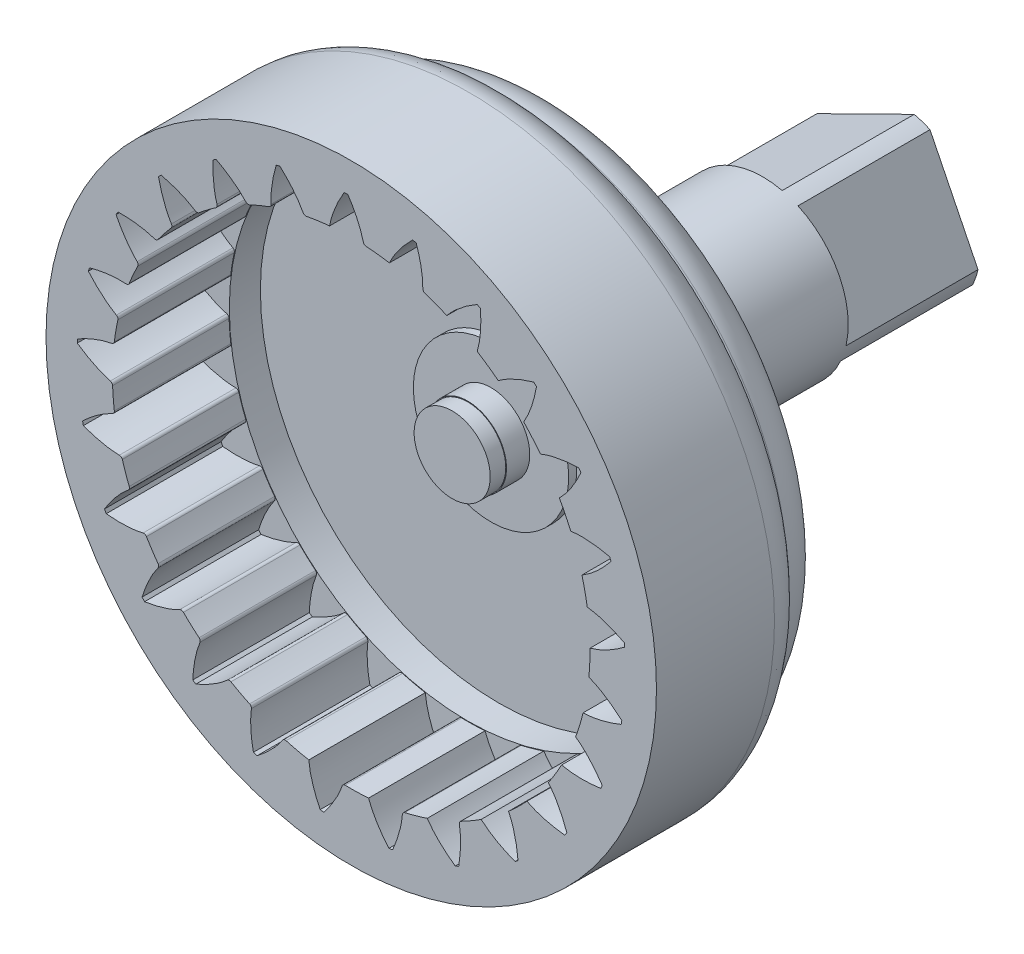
SolidWorks part; units mm, degrees
ref_plane "Plan de face" through (0, 0, 0) normal (0, 0, 1) x (1, 0, 0)
ref_plane "Plan de dessus" through (0, 0, 0) normal (0, 1, 0) x (1, 0, 0)
ref_plane "Plan de droite" through (0, 0, 0) normal (1, 0, 0) x (0, 0, -1)
ref_plane "Plan4" through (0, 0, 0) normal (0, -1, 0) x (1, 0, 0)
sketch "Esquisse1" plane through (0, 0, 0) normal (0, -1, 0) x (1, 0, 0)
  line L0 (3.9307, 4.1) -> (0, 4.1)
  line L1 (0, 4.1) -> (0, 1.5)
  line L2 (0, 1.5) -> (3.5707, 1.5)
  line L3 (3.5707, 1.5) -> (3.5707, 2.1)
  line L4 (3.9307, 2.58) -> (3.9307, 4.1)
  line L5 (0, 4.1) -> (0, 1.5) construction
  spline S0 degree 3 poles (3.5707, 2.1) (3.7627, 2.156) (3.9307, 2.38) (3.9307, 2.58) knots 0 0 0 0 1 1 1 1
revolve "Révolution1" add sketch "Esquisse1" angle 360 about L5
sketch "Esquisse2" plane through (0, 0, 1.5) normal (0, 0, -1) x (-1, 0, 0)
  circle A0 centre (0, 0) radius 1.1
extrude "Boss.-Extru.1" add sketch "Esquisse2" along normal blind 4.4
sketch "Esquisse3" plane through (0, 0, -2.9) normal (0, 0, -1) x (-1, 0, 0)
  line L0 (1.0713, 0.2496) -> (0.4529, -1.0024)
  arc A0 (0.4529, -1.0024) -> (1.0713, 0.2496) centre (0, 0) ccw
extrude "Enlèv. mat.-Extru.1" cut sketch "Esquisse3" against normal blind 1.7
sketch "Esquisse4" plane through (0, 0, -2.9) normal (0, 0, -1) x (-1, 0, 0)
  line L0 (-0.2496, 1.0713) -> (1.0024, 0.4529)
  arc A0 (1.0024, 0.4529) -> (-0.2496, 1.0713) centre (0, 0) ccw
extrude "Enlèv. mat.-Extru.2" cut sketch "Esquisse4" against normal blind 1.7
sketch "Esquisse5" plane through (0, 0, -2.9) normal (0, 0, -1) x (-1, 0, 0)
  line L0 (0.2496, -1.0713) -> (-1.0024, -0.4529)
  arc A0 (-1.0024, -0.4529) -> (0.2496, -1.0713) centre (0, 0) ccw
extrude "Enlèv. mat.-Extru.3" cut sketch "Esquisse5" against normal blind 1.7
sketch "Esquisse6" plane through (0, 0, -2.9) normal (0, 0, -1) x (-1, 0, 0)
  line L0 (-1.0713, -0.2496) -> (-0.4529, 1.0024)
  arc A0 (-0.4529, 1.0024) -> (-1.0713, -0.2496) centre (0, 0) ccw
extrude "Enlèv. mat.-Extru.4" cut sketch "Esquisse6" against normal blind 1.7
sketch "Esquisse7" plane through (0, 0, 4.1) normal (0, 0, 1) x (1, 0, 0)
  arc A0 (1.231, 2.818) -> (0.9214, 2.9339) centre (0, 0) ccw
  arc A1 (0.8366, 3.4302) -> (0.7899, 3.4413) centre (0, 0) ccw
  arc A2 (0.4915, 3.0356) -> (0.1629, 3.0708) centre (0, 0) ccw
  arc A3 (-0.0428, 3.5305) -> (-0.0907, 3.5296) centre (0, 0) ccw
  arc A4 (-0.2788, 3.0625) -> (-0.6059, 3.0149) centre (0, 0) ccw
  arc A5 (-0.9194, 3.4089) -> (-0.9656, 3.3961) centre (0, 0) ccw
  arc A6 (-1.0317, 2.8969) -> (-1.3367, 2.7695) centre (0, 0) ccw
  arc A7 (-1.7383, 3.0732) -> (-1.7799, 3.0493) centre (0, 0) ccw
  arc A8 (-1.7197, 2.5493) -> (-1.9834, 2.35) centre (0, 0) ccw
  arc A9 (-2.448, 2.5443) -> (-2.4823, 2.5108) centre (0, 0) ccw
  arc A10 (-2.2997, 2.0416) -> (-2.5055, 1.783) centre (0, 0) ccw
  arc A11 (-3.0038, 1.8556) -> (-3.0287, 1.8146) centre (0, 0) ccw
  arc A12 (-2.7352, 1.4055) -> (-2.8702, 1.1039) centre (0, 0) ccw
  arc A13 (-3.3709, 1.0503) -> (-3.3849, 1.0044) centre (0, 0) ccw
  arc A14 (-2.9988, 0.6812) -> (-3.0546, 0.3554) centre (0, 0) ccw
  arc A15 (-3.5262, 0.179) -> (-3.5283, 0.1311) centre (0, 0) ccw
  arc A16 (-3.074, -0.086) -> (-3.047, -0.4154) centre (0, 0) ccw
  arc A17 (-3.4599, -0.7036) -> (-3.4501, -0.7505) centre (0, 0) ccw
  arc A18 (-2.956, -0.8478) -> (-2.8479, -1.1601) centre (0, 0) ccw
  arc A19 (-3.1763, -1.5419) -> (-3.155, -1.5849) centre (0, 0) ccw
  arc A20 (-2.6523, -1.5563) -> (-2.47, -1.8319) centre (0, 0) ccw
  arc A21 (-2.693, -2.2834) -> (-2.6618, -2.3197) centre (0, 0) ccw
  arc A22 (-2.1819, -2.167) -> (-1.9368, -2.3886) centre (0, 0) ccw
  arc A23 (-2.0406, -2.8814) -> (-2.0012, -2.9088) centre (0, 0) ccw
  arc A24 (-1.5745, -2.6415) -> (-1.2819, -2.7952) centre (0, 0) ccw
  arc A25 (-1.2599, -3.2983) -> (-1.215, -3.3151) centre (0, 0) ccw
  arc A26 (-0.8681, -2.9501) -> (-0.5465, -3.0262) centre (0, 0) ccw
  arc A27 (-0.4001, -3.508) -> (-0.3524, -3.5131) centre (0, 0) ccw
  arc A28 (-0.1072, -3.0733) -> (0.2233, -3.067) centre (0, 0) ccw
  arc A29 (0.4849, -3.4973) -> (0.5324, -3.4904) centre (0, 0) ccw
  arc A30 (0.6605, -3.0034) -> (0.979, -2.9152) centre (0, 0) ccw
  arc A31 (1.3394, -3.2668) -> (1.3837, -3.2483) centre (0, 0) ccw
  arc A32 (1.3866, -2.7448) -> (1.6732, -2.5801) centre (0, 0) ccw
  arc A33 (2.1098, -2.8311) -> (2.148, -2.8022) centre (0, 0) ccw
  arc A34 (2.0257, -2.3137) -> (2.2623, -2.0829) centre (0, 0) ccw
  arc A35 (2.7475, -2.2175) -> (2.7774, -2.1799) centre (0, 0) ccw
  arc A36 (2.5374, -1.7373) -> (2.7092, -1.4549) centre (0, 0) ccw
  arc A37 (3.2127, -1.4645) -> (3.2323, -1.4207) centre (0, 0) ccw
  arc A38 (2.8898, -1.0516) -> (2.9859, -0.7354) centre (0, 0) ccw
  arc A39 (3.476, -0.6195) -> (3.4841, -0.5723) centre (0, 0) ccw
  arc A40 (3.0605, -0.2999) -> (3.075, 0.0303) centre (0, 0) ccw
  arc A41 (3.5208, 0.2644) -> (3.5169, 0.3122) centre (0, 0) ccw
  arc A42 (3.0389, 0.4706) -> (2.9709, 0.794) centre (0, 0) ccw
  arc A43 (3.3445, 1.1317) -> (3.3288, 1.177) centre (0, 0) ccw
  arc A44 (2.8264, 1.2116) -> (2.6799, 1.5082) centre (0, 0) ccw
  arc A45 (2.958, 1.9278) -> (2.9315, 1.9678) centre (0, 0) ccw
  arc A46 (2.4366, 1.8761) -> (2.2209, 2.1271) centre (0, 0) ccw
  arc A47 (2.3856, 2.6029) -> (2.35, 2.6351) centre (0, 0) ccw
  arc A48 (1.8932, 2.4233) -> (1.6221, 2.6125) centre (0, 0) ccw
  arc A49 (1.6633, 3.1144) -> (1.6209, 3.1367) centre (0, 0) ccw
  spline S0 degree 3 poles (0.8366, 3.4302) (0.8499, 3.3911) (0.8621, 3.3516) (0.8728, 3.3116) (0.8835, 3.2717) (0.8928, 3.2314) (0.9004, 3.1908) (0.9143, 3.1159) (0.9228, 3.0395) (0.9219, 2.9634) (0.9218, 2.9536) (0.9216, 2.9437) (0.9214, 2.9339) knots 0 0 0 0 0.000124 0.000124 0.000124 0.000248 0.000248 0.000248 0.000477 0.000477 0.000477 0.000507 0.000507 0.000507 0.000507
  spline S1 degree 3 poles (0.4915, 3.0356) (0.4958, 3.0445) (0.5, 3.0534) (0.5043, 3.0622) (0.5225, 3.0994) (0.5431, 3.1355) (0.5655, 3.1703) (0.5879, 3.2051) (0.612, 3.2387) (0.6375, 3.2713) (0.6843, 3.3313) (0.7356, 3.3879) (0.7899, 3.4413) knots -0.000029 -0.000029 -0.000029 -0.000029 0 0 0 0.000124 0.000124 0.000124 0.000248 0.000248 0.000248 0.000477 0.000477 0.000477 0.000477
  spline S2 degree 3 poles (-0.0428, 3.5305) (-0.0201, 3.4959) (0.0015, 3.4606) (0.0218, 3.4247) (0.0421, 3.3886) (0.0611, 3.3519) (0.0786, 3.3144) (0.1107, 3.2454) (0.1379, 3.1735) (0.156, 3.0996) (0.1583, 3.09) (0.1606, 3.0804) (0.1629, 3.0708) knots 0 0 0 0 0.000124 0.000124 0.000124 0.000248 0.000248 0.000248 0.000477 0.000477 0.000477 0.000507 0.000507 0.000507 0.000507
  spline S3 degree 3 poles (-0.2788, 3.0625) (-0.2769, 3.0722) (-0.275, 3.0818) (-0.2731, 3.0915) (-0.2648, 3.132) (-0.2538, 3.1721) (-0.2407, 3.2113) (-0.2277, 3.2506) (-0.2126, 3.2892) (-0.1961, 3.3271) (-0.1657, 3.3968) (-0.13, 3.4644) (-0.0907, 3.5296) knots -0.000029 -0.000029 -0.000029 -0.000029 0 0 0 0.000124 0.000124 0.000124 0.000248 0.000248 0.000248 0.000477 0.000477 0.000477 0.000477
  spline S4 degree 3 poles (-0.9194, 3.4089) (-0.8889, 3.3811) (-0.8592, 3.3523) (-0.8306, 3.3225) (-0.802, 3.2927) (-0.7744, 3.2618) (-0.7482, 3.2298) (-0.6999, 3.171) (-0.6556, 3.1081) (-0.6197, 3.041) (-0.6151, 3.0323) (-0.6105, 3.0236) (-0.6059, 3.0149) knots 0 0 0 0 0.000124 0.000124 0.000124 0.000248 0.000248 0.000248 0.000477 0.000477 0.000477 0.000507 0.000507 0.000507 0.000507
  spline S5 degree 3 poles (-1.0317, 2.8969) (-1.0322, 2.9068) (-1.0328, 2.9166) (-1.0333, 2.9264) (-1.0353, 2.9678) (-1.0347, 3.0093) (-1.0318, 3.0506) (-1.0289, 3.0918) (-1.0239, 3.133) (-1.0174, 3.1738) (-1.0052, 3.2489) (-0.9875, 3.3232) (-0.9656, 3.3961) knots -0.000029 -0.000029 -0.000029 -0.000029 0 0 0 0.000124 0.000124 0.000124 0.000248 0.000248 0.000248 0.000477 0.000477 0.000477 0.000477
  spline S6 degree 3 poles (-1.7383, 3.0732) (-1.7018, 3.0538) (-1.6659, 3.0333) (-1.6307, 3.0115) (-1.5956, 2.9898) (-1.5612, 2.9667) (-1.5279, 2.9423) (-1.4665, 2.8973) (-1.408, 2.8474) (-1.3565, 2.7913) (-1.3499, 2.7841) (-1.3433, 2.7768) (-1.3367, 2.7695) knots 0 0 0 0 0.000124 0.000124 0.000124 0.000248 0.000248 0.000248 0.000477 0.000477 0.000477 0.000507 0.000507 0.000507 0.000507
  spline S7 degree 3 poles (-1.7197, 2.5493) (-1.7227, 2.5587) (-1.7257, 2.5681) (-1.7286, 2.5775) (-1.7409, 2.617) (-1.7505, 2.6574) (-1.758, 2.6981) (-1.7655, 2.7388) (-1.7709, 2.7799) (-1.7747, 2.8211) (-1.7816, 2.8968) (-1.783, 2.9733) (-1.7799, 3.0493) knots -0.000029 -0.000029 -0.000029 -0.000029 0 0 0 0.000124 0.000124 0.000124 0.000248 0.000248 0.000248 0.000477 0.000477 0.000477 0.000477
  spline S8 degree 3 poles (-2.448, 2.5443) (-2.4078, 2.5347) (-2.3679, 2.5237) (-2.3284, 2.5114) (-2.289, 2.499) (-2.25, 2.4853) (-2.2116, 2.4699) (-2.1409, 2.4416) (-2.0719, 2.4078) (-2.0081, 2.3663) (-1.9998, 2.3609) (-1.9916, 2.3555) (-1.9834, 2.35) knots 0 0 0 0 0.000124 0.000124 0.000124 0.000248 0.000248 0.000248 0.000477 0.000477 0.000477 0.000507 0.000507 0.000507 0.000507
  spline S9 degree 3 poles (-2.2997, 2.0416) (-2.3049, 2.0499) (-2.3101, 2.0583) (-2.3153, 2.0667) (-2.337, 2.1019) (-2.3564, 2.1386) (-2.3738, 2.1762) (-2.3911, 2.2137) (-2.4066, 2.2521) (-2.4205, 2.2911) (-2.4461, 2.3628) (-2.4664, 2.4364) (-2.4823, 2.5108) knots -0.000029 -0.000029 -0.000029 -0.000029 0 0 0 0.000124 0.000124 0.000124 0.000248 0.000248 0.000248 0.000477 0.000477 0.000477 0.000477
  spline S10 degree 3 poles (-3.0038, 1.8556) (-2.9625, 1.8563) (-2.9211, 1.8556) (-2.8799, 1.8534) (-2.8386, 1.8513) (-2.7973, 1.8476) (-2.7564, 1.8423) (-2.6809, 1.8325) (-2.6056, 1.8169) (-2.5335, 1.7925) (-2.5241, 1.7894) (-2.5148, 1.7862) (-2.5055, 1.783) knots 0 0 0 0 0.000124 0.000124 0.000124 0.000248 0.000248 0.000248 0.000477 0.000477 0.000477 0.000507 0.000507 0.000507 0.000507
  spline S11 degree 3 poles (-2.7352, 1.4055) (-2.7423, 1.4123) (-2.7494, 1.4191) (-2.7565, 1.4259) (-2.7863, 1.4547) (-2.8142, 1.4854) (-2.8404, 1.5175) (-2.8665, 1.5495) (-2.8911, 1.5829) (-2.9142, 1.6172) (-2.9568, 1.6802) (-2.9948, 1.7465) (-3.0287, 1.8146) knots -0.000029 -0.000029 -0.000029 -0.000029 0 0 0 0.000124 0.000124 0.000124 0.000248 0.000248 0.000248 0.000477 0.000477 0.000477 0.000477
  spline S12 degree 3 poles (-3.3709, 1.0503) (-3.331, 1.0612) (-3.2908, 1.0708) (-3.2503, 1.079) (-3.2098, 1.0872) (-3.1689, 1.0939) (-3.1279, 1.0989) (-3.0524, 1.1082) (-2.9756, 1.1118) (-2.8997, 1.1062) (-2.8898, 1.1054) (-2.88, 1.1046) (-2.8702, 1.1039) knots 0 0 0 0 0.000124 0.000124 0.000124 0.000248 0.000248 0.000248 0.000477 0.000477 0.000477 0.000507 0.000507 0.000507 0.000507
  spline S13 degree 3 poles (-2.9988, 0.6812) (-3.0074, 0.686) (-3.016, 0.6908) (-3.0245, 0.6956) (-3.0605, 0.716) (-3.0952, 0.7389) (-3.1285, 0.7634) (-3.1618, 0.7879) (-3.1939, 0.8142) (-3.2248, 0.8416) (-3.2818, 0.8921) (-3.3351, 0.9469) (-3.3849, 1.0044) knots -0.000029 -0.000029 -0.000029 -0.000029 0 0 0 0.000124 0.000124 0.000124 0.000248 0.000248 0.000248 0.000477 0.000477 0.000477 0.000477
  spline S14 degree 3 poles (-3.5262, 0.179) (-3.4903, 0.1995) (-3.4537, 0.2188) (-3.4165, 0.2368) (-3.3793, 0.2548) (-3.3414, 0.2715) (-3.3029, 0.2865) (-3.2321, 0.3143) (-3.1586, 0.3369) (-3.0837, 0.3503) (-3.074, 0.352) (-3.0643, 0.3537) (-3.0546, 0.3554) knots 0 0 0 0 0.000124 0.000124 0.000124 0.000248 0.000248 0.000248 0.000477 0.000477 0.000477 0.000507 0.000507 0.000507 0.000507
  spline S15 degree 3 poles (-3.074, -0.086) (-3.0835, -0.0835) (-3.093, -0.081) (-3.1025, -0.0784) (-3.1424, -0.0676) (-3.1817, -0.0541) (-3.2201, -0.0386) (-3.2584, -0.0231) (-3.296, -0.0057) (-3.3328, 0.0132) (-3.4005, 0.0479) (-3.4658, 0.0877) (-3.5283, 0.1311) knots -0.000029 -0.000029 -0.000029 -0.000029 0 0 0 0.000124 0.000124 0.000124 0.000248 0.000248 0.000248 0.000477 0.000477 0.000477 0.000477
  spline S16 degree 3 poles (-3.4599, -0.7036) (-3.4303, -0.6748) (-3.3996, -0.647) (-3.3681, -0.6203) (-3.3365, -0.5936) (-3.304, -0.568) (-3.2704, -0.5439) (-3.2087, -0.4994) (-3.1432, -0.4592) (-3.0739, -0.4276) (-3.0649, -0.4235) (-3.056, -0.4195) (-3.047, -0.4154) knots 0 0 0 0 0.000124 0.000124 0.000124 0.000248 0.000248 0.000248 0.000477 0.000477 0.000477 0.000507 0.000507 0.000507 0.000507
  spline S17 degree 3 poles (-2.956, -0.8478) (-2.9658, -0.8477) (-2.9757, -0.8476) (-2.9855, -0.8475) (-3.0269, -0.847) (-3.0683, -0.8437) (-3.1093, -0.8382) (-3.1503, -0.8327) (-3.1911, -0.8252) (-3.2314, -0.8161) (-3.3056, -0.7993) (-3.3787, -0.7769) (-3.4501, -0.7505) knots -0.000029 -0.000029 -0.000029 -0.000029 0 0 0 0.000124 0.000124 0.000124 0.000248 0.000248 0.000248 0.000477 0.000477 0.000477 0.000477
  spline S18 degree 3 poles (-3.1763, -1.5419) (-3.1547, -1.5067) (-3.1319, -1.4721) (-3.108, -1.4384) (-3.0841, -1.4047) (-3.0589, -1.3719) (-3.0324, -1.3401) (-2.9837, -1.2816) (-2.9302, -1.2264) (-2.871, -1.1786) (-2.8633, -1.1724) (-2.8556, -1.1663) (-2.8479, -1.1601) knots 0 0 0 0 0.000124 0.000124 0.000124 0.000248 0.000248 0.000248 0.000477 0.000477 0.000477 0.000507 0.000507 0.000507 0.000507
  spline S19 degree 3 poles (-2.6523, -1.5563) (-2.6619, -1.5586) (-2.6714, -1.561) (-2.681, -1.5634) (-2.7212, -1.5731) (-2.7621, -1.5802) (-2.8032, -1.5851) (-2.8443, -1.59) (-2.8856, -1.5929) (-2.9269, -1.594) (-3.003, -1.5962) (-3.0793, -1.5928) (-3.155, -1.5849) knots -0.000029 -0.000029 -0.000029 -0.000029 0 0 0 0.000124 0.000124 0.000124 0.000248 0.000248 0.000248 0.000477 0.000477 0.000477 0.000477
  spline S20 degree 3 poles (-2.693, -2.2834) (-2.6809, -2.2439) (-2.6674, -2.2047) (-2.6526, -2.1662) (-2.6378, -2.1276) (-2.6216, -2.0895) (-2.6039, -2.0522) (-2.5712, -1.9834) (-2.5332, -1.9166) (-2.4877, -1.8555) (-2.4818, -1.8476) (-2.4759, -1.8398) (-2.47, -1.8319) knots 0 0 0 0 0.000124 0.000124 0.000124 0.000248 0.000248 0.000248 0.000477 0.000477 0.000477 0.000507 0.000507 0.000507 0.000507
  spline S21 degree 3 poles (-2.1819, -2.167) (-2.1906, -2.1716) (-2.1993, -2.1763) (-2.208, -2.181) (-2.2445, -2.2004) (-2.2823, -2.2175) (-2.3209, -2.2325) (-2.3595, -2.2474) (-2.3988, -2.2604) (-2.4386, -2.2719) (-2.5117, -2.2929) (-2.5865, -2.3085) (-2.6618, -2.3197) knots -0.000029 -0.000029 -0.000029 -0.000029 0 0 0 0.000124 0.000124 0.000124 0.000248 0.000248 0.000248 0.000477 0.000477 0.000477 0.000477
  spline S22 degree 3 poles (-2.0406, -2.8814) (-2.0386, -2.8401) (-2.0353, -2.7988) (-2.0306, -2.7578) (-2.0258, -2.7167) (-2.0196, -2.6758) (-2.0117, -2.6352) (-1.9972, -2.5605) (-1.9769, -2.4864) (-1.9481, -2.4159) (-1.9444, -2.4068) (-1.9405, -2.3977) (-1.9368, -2.3886) knots 0 0 0 0 0.000124 0.000124 0.000124 0.000248 0.000248 0.000248 0.000477 0.000477 0.000477 0.000507 0.000507 0.000507 0.000507
  spline S23 degree 3 poles (-1.5745, -2.6415) (-1.5817, -2.6482) (-1.5889, -2.6549) (-1.5962, -2.6615) (-1.6267, -2.6895) (-1.6592, -2.7154) (-1.6928, -2.7395) (-1.7264, -2.7636) (-1.7613, -2.786) (-1.797, -2.8069) (-1.8626, -2.8455) (-1.9311, -2.8792) (-2.0012, -2.9088) knots -0.000029 -0.000029 -0.000029 -0.000029 0 0 0 0.000124 0.000124 0.000124 0.000248 0.000248 0.000248 0.000477 0.000477 0.000477 0.000477
  spline S24 degree 3 poles (-1.2599, -3.2983) (-1.2683, -3.2578) (-1.2753, -3.2171) (-1.281, -3.1761) (-1.2866, -3.1352) (-1.2907, -3.094) (-1.2932, -3.0527) (-1.2977, -2.9768) (-1.2965, -2.8999) (-1.2861, -2.8245) (-1.2847, -2.8147) (-1.2833, -2.805) (-1.2819, -2.7952) knots 0 0 0 0 0.000124 0.000124 0.000124 0.000248 0.000248 0.000248 0.000477 0.000477 0.000477 0.000507 0.000507 0.000507 0.000507
  spline S25 degree 3 poles (-0.8681, -2.9501) (-0.8735, -2.9584) (-0.8788, -2.9666) (-0.8842, -2.9749) (-0.9068, -3.0095) (-0.9318, -3.0427) (-0.9583, -3.0744) (-0.9849, -3.1061) (-1.0131, -3.1365) (-1.0424, -3.1656) (-1.0964, -3.2193) (-1.1544, -3.269) (-1.215, -3.3151) knots -0.000029 -0.000029 -0.000029 -0.000029 0 0 0 0.000124 0.000124 0.000124 0.000248 0.000248 0.000248 0.000477 0.000477 0.000477 0.000477
  spline S26 degree 3 poles (-0.4001, -3.508) (-0.4182, -3.4709) (-0.4352, -3.4332) (-0.4508, -3.3949) (-0.4665, -3.3567) (-0.4807, -3.3178) (-0.4934, -3.2784) (-0.5166, -3.206) (-0.5346, -3.1312) (-0.5432, -3.0556) (-0.5444, -3.0458) (-0.5454, -3.036) (-0.5465, -3.0262) knots 0 0 0 0 0.000124 0.000124 0.000124 0.000248 0.000248 0.000248 0.000477 0.000477 0.000477 0.000507 0.000507 0.000507 0.000507
  spline S27 degree 3 poles (-0.1072, -3.0733) (-0.1103, -3.0826) (-0.1134, -3.092) (-0.1166, -3.1013) (-0.1299, -3.1405) (-0.1458, -3.1788) (-0.1637, -3.2162) (-0.1815, -3.2535) (-0.2013, -3.2899) (-0.2224, -3.3254) (-0.2614, -3.3908) (-0.3052, -3.4534) (-0.3524, -3.5131) knots -0.000029 -0.000029 -0.000029 -0.000029 0 0 0 0.000124 0.000124 0.000124 0.000248 0.000248 0.000248 0.000477 0.000477 0.000477 0.000477
  spline S28 degree 3 poles (0.4849, -3.4973) (0.4581, -3.4659) (0.4322, -3.4335) (0.4076, -3.4004) (0.383, -3.3672) (0.3595, -3.3331) (0.3375, -3.2981) (0.2969, -3.2337) (0.2609, -3.1658) (0.2337, -3.0947) (0.2302, -3.0855) (0.2268, -3.0763) (0.2233, -3.067) knots 0 0 0 0 0.000124 0.000124 0.000124 0.000248 0.000248 0.000248 0.000477 0.000477 0.000477 0.000507 0.000507 0.000507 0.000507
  spline S29 degree 3 poles (0.6605, -3.0034) (0.6598, -3.0132) (0.6591, -3.023) (0.6584, -3.0329) (0.6552, -3.0741) (0.6493, -3.1152) (0.6413, -3.1558) (0.6333, -3.1964) (0.6232, -3.2366) (0.6116, -3.2763) (0.5901, -3.3493) (0.5632, -3.4208) (0.5324, -3.4904) knots -0.000029 -0.000029 -0.000029 -0.000029 0 0 0 0.000124 0.000124 0.000124 0.000248 0.000248 0.000248 0.000477 0.000477 0.000477 0.000477
  spline S30 degree 3 poles (1.3394, -3.2668) (1.3056, -3.243) (1.2726, -3.2182) (1.2404, -3.1922) (1.2083, -3.1662) (1.1771, -3.139) (1.1471, -3.1106) (1.0918, -3.0583) (1.04, -3.0014) (0.996, -2.9393) (0.9903, -2.9313) (0.9847, -2.9232) (0.979, -2.9152) knots 0 0 0 0 0.000124 0.000124 0.000124 0.000248 0.000248 0.000248 0.000477 0.000477 0.000477 0.000507 0.000507 0.000507 0.000507
  spline S31 degree 3 poles (1.3866, -2.7448) (1.3884, -2.7545) (1.3902, -2.7641) (1.3919, -2.7738) (1.3991, -2.8146) (1.4037, -2.8559) (1.406, -2.8972) (1.4083, -2.9385) (1.4085, -2.9799) (1.4071, -3.0212) (1.4045, -3.0973) (1.3963, -3.1733) (1.3837, -3.2483) knots -0.000029 -0.000029 -0.000029 -0.000029 0 0 0 0.000124 0.000124 0.000124 0.000248 0.000248 0.000248 0.000477 0.000477 0.000477 0.000477
  spline S32 degree 3 poles (2.1098, -2.8311) (2.0711, -2.8165) (2.0329, -2.8006) (1.9953, -2.7834) (1.9577, -2.7662) (1.9207, -2.7477) (1.8846, -2.7276) (1.818, -2.6907) (1.7538, -2.6485) (1.6957, -2.5993) (1.6882, -2.5929) (1.6807, -2.5865) (1.6732, -2.5801) knots 0 0 0 0 0.000124 0.000124 0.000124 0.000248 0.000248 0.000248 0.000477 0.000477 0.000477 0.000507 0.000507 0.000507 0.000507
  spline S33 degree 3 poles (2.0257, -2.3137) (2.0298, -2.3227) (2.034, -2.3316) (2.038, -2.3405) (2.0551, -2.3782) (2.0698, -2.4171) (2.0823, -2.4565) (2.0948, -2.4959) (2.1054, -2.536) (2.1143, -2.5764) (2.1306, -2.6507) (2.1416, -2.7263) (2.148, -2.8022) knots -0.000029 -0.000029 -0.000029 -0.000029 0 0 0 0.000124 0.000124 0.000124 0.000248 0.000248 0.000248 0.000477 0.000477 0.000477 0.000477
  spline S34 degree 3 poles (2.7475, -2.2175) (2.7065, -2.2129) (2.6655, -2.2071) (2.6248, -2.1997) (2.5842, -2.1924) (2.5437, -2.1837) (2.5037, -2.1732) (2.4301, -2.154) (2.3573, -2.1291) (2.2888, -2.0959) (2.28, -2.0916) (2.2711, -2.0873) (2.2623, -2.0829) knots 0 0 0 0 0.000124 0.000124 0.000124 0.000248 0.000248 0.000248 0.000477 0.000477 0.000477 0.000507 0.000507 0.000507 0.000507
  spline S35 degree 3 poles (2.5374, -1.7373) (2.5436, -1.7449) (2.5499, -1.7525) (2.5561, -1.7602) (2.582, -1.7924) (2.6059, -1.8264) (2.6278, -1.8615) (2.6497, -1.8966) (2.6699, -1.9328) (2.6886, -1.9697) (2.7229, -2.0376) (2.7523, -2.1081) (2.7774, -2.1799) knots -0.000029 -0.000029 -0.000029 -0.000029 0 0 0 0.000124 0.000124 0.000124 0.000248 0.000248 0.000248 0.000477 0.000477 0.000477 0.000477
  spline S36 degree 3 poles (3.2127, -1.4645) (3.1718, -1.4703) (3.1306, -1.4748) (3.0894, -1.4779) (3.0482, -1.4809) (3.0069, -1.4825) (2.9655, -1.4823) (2.8894, -1.482) (2.8128, -1.476) (2.7382, -1.4609) (2.7285, -1.4589) (2.7189, -1.4569) (2.7092, -1.4549) knots 0 0 0 0 0.000124 0.000124 0.000124 0.000248 0.000248 0.000248 0.000477 0.000477 0.000477 0.000507 0.000507 0.000507 0.000507
  spline S37 degree 3 poles (2.8898, -1.0516) (2.8977, -1.0575) (2.9056, -1.0633) (2.9135, -1.0692) (2.9466, -1.094) (2.9782, -1.121) (3.0082, -1.1495) (3.0381, -1.178) (3.0667, -1.2081) (3.0939, -1.2392) (3.1441, -1.2964) (3.1901, -1.3574) (3.2323, -1.4207) knots -0.000029 -0.000029 -0.000029 -0.000029 0 0 0 0.000124 0.000124 0.000124 0.000248 0.000248 0.000248 0.000477 0.000477 0.000477 0.000477
  spline S38 degree 3 poles (3.476, -0.6195) (3.4378, -0.6353) (3.3991, -0.6499) (3.3599, -0.6631) (3.3207, -0.6763) (3.2811, -0.6881) (3.241, -0.6982) (3.1672, -0.7169) (3.0915, -0.7301) (3.0154, -0.734) (3.0056, -0.7345) (2.9958, -0.735) (2.9859, -0.7354) knots 0 0 0 0 0.000124 0.000124 0.000124 0.000248 0.000248 0.000248 0.000477 0.000477 0.000477 0.000507 0.000507 0.000507 0.000507
  spline S39 degree 3 poles (3.0605, -0.2999) (3.0696, -0.3036) (3.0788, -0.3073) (3.0879, -0.3111) (3.1261, -0.3268) (3.1634, -0.3451) (3.1995, -0.3653) (3.2357, -0.3854) (3.2708, -0.4075) (3.3049, -0.4308) (3.3677, -0.4737) (3.4274, -0.5214) (3.4841, -0.5723) knots -0.000029 -0.000029 -0.000029 -0.000029 0 0 0 0.000124 0.000124 0.000124 0.000248 0.000248 0.000248 0.000477 0.000477 0.000477 0.000477
  spline S40 degree 3 poles (3.5208, 0.2644) (3.4878, 0.2396) (3.4539, 0.2158) (3.4193, 0.1933) (3.3846, 0.1708) (3.3491, 0.1495) (3.3128, 0.1297) (3.246, 0.0933) (3.1759, 0.0616) (3.1032, 0.0389) (3.0939, 0.036) (3.0844, 0.0332) (3.075, 0.0303) knots 0 0 0 0 0.000124 0.000124 0.000124 0.000248 0.000248 0.000248 0.000477 0.000477 0.000477 0.000507 0.000507 0.000507 0.000507
  spline S41 degree 3 poles (3.0389, 0.4706) (3.0487, 0.4693) (3.0585, 0.468) (3.0682, 0.4666) (3.1092, 0.4609) (3.1499, 0.4524) (3.1899, 0.4419) (3.2299, 0.4313) (3.2693, 0.4187) (3.3082, 0.4046) (3.3797, 0.3786) (3.4494, 0.3473) (3.5169, 0.3122) knots -0.000029 -0.000029 -0.000029 -0.000029 0 0 0 0.000124 0.000124 0.000124 0.000248 0.000248 0.000248 0.000477 0.000477 0.000477 0.000477
  spline S42 degree 3 poles (3.3445, 1.1317) (3.3186, 1.0994) (3.2917, 1.068) (3.2638, 1.0375) (3.2358, 1.0071) (3.2067, 0.9777) (3.1765, 0.9495) (3.1208, 0.8976) (3.0608, 0.8495) (2.9961, 0.8095) (2.9877, 0.8043) (2.9793, 0.7992) (2.9709, 0.794) knots 0 0 0 0 0.000124 0.000124 0.000124 0.000248 0.000248 0.000248 0.000477 0.000477 0.000477 0.000507 0.000507 0.000507 0.000507
  spline S43 degree 3 poles (2.8264, 1.2116) (2.8362, 1.2127) (2.846, 1.2139) (2.8558, 1.215) (2.8969, 1.2196) (2.9384, 1.2216) (2.9798, 1.2213) (3.0211, 1.221) (3.0625, 1.2186) (3.1036, 1.2146) (3.1794, 1.2073) (3.2547, 1.1943) (3.3288, 1.177) knots -0.000029 -0.000029 -0.000029 -0.000029 0 0 0 0.000124 0.000124 0.000124 0.000248 0.000248 0.000248 0.000477 0.000477 0.000477 0.000477
  spline S44 degree 3 poles (2.958, 1.9278) (2.9399, 1.8879) (2.9205, 1.8485) (2.8996, 1.81) (2.8787, 1.7714) (2.8563, 1.7336) (2.8323, 1.6969) (2.7881, 1.6293) (2.7379, 1.5646) (2.6799, 1.5082) knots 0 0 0 0 0.000132 0.000132 0.000132 0.000263 0.000263 0.000263 0.000507 0.000507 0.000507 0.000507
  spline S45 degree 3 poles (2.4366, 1.8761) (2.4771, 1.8931) (2.5189, 1.907) (2.5614, 1.9185) (2.6037, 1.9299) (2.6468, 1.9389) (2.6901, 1.9461) (2.7698, 1.9592) (2.8507, 1.966) (2.9315, 1.9678) knots 0 0 0 0 0.000132 0.000132 0.000132 0.000263 0.000263 0.000263 0.000506 0.000506 0.000506 0.000506
  spline S46 degree 3 poles (2.3856, 2.6029) (2.3785, 2.5622) (2.3701, 2.5217) (2.3602, 2.4815) (2.3504, 2.4414) (2.3391, 2.4016) (2.3262, 2.3623) (2.3024, 2.29) (2.273, 2.219) (2.2355, 2.1527) (2.2307, 2.1441) (2.2258, 2.1356) (2.2209, 2.1271) knots 0 0 0 0 0.000124 0.000124 0.000124 0.000248 0.000248 0.000248 0.000477 0.000477 0.000477 0.000507 0.000507 0.000507 0.000507
  spline S47 degree 3 poles (1.8932, 2.4233) (1.9012, 2.4291) (1.9092, 2.4348) (1.9172, 2.4405) (1.951, 2.4644) (1.9864, 2.486) (2.0228, 2.5057) (2.0592, 2.5254) (2.0966, 2.5433) (2.1346, 2.5596) (2.2045, 2.5896) (2.2768, 2.6145) (2.35, 2.6351) knots -0.000029 -0.000029 -0.000029 -0.000029 0 0 0 0.000124 0.000124 0.000124 0.000248 0.000248 0.000248 0.000477 0.000477 0.000477 0.000477
  spline S48 degree 3 poles (1.6633, 3.1144) (1.6666, 3.0732) (1.6685, 3.0319) (1.6689, 2.9905) (1.6694, 2.9492) (1.6683, 2.9078) (1.6656, 2.8666) (1.6605, 2.7906) (1.6497, 2.7145) (1.6299, 2.641) (1.6274, 2.6315) (1.6247, 2.622) (1.6221, 2.6125) knots 0 0 0 0 0.000124 0.000124 0.000124 0.000248 0.000248 0.000248 0.000477 0.000477 0.000477 0.000507 0.000507 0.000507 0.000507
  spline S49 degree 3 poles (1.231, 2.818) (1.2374, 2.8256) (1.2437, 2.8331) (1.25, 2.8406) (1.2768, 2.8721) (1.3058, 2.9019) (1.3361, 2.9301) (1.3664, 2.9582) (1.3982, 2.9848) (1.431, 3.01) (1.4912, 3.0565) (1.555, 3.0986) (1.6209, 3.1367) knots -0.000029 -0.000029 -0.000029 -0.000029 0 0 0 0.000124 0.000124 0.000124 0.000248 0.000248 0.000248 0.000477 0.000477 0.000477 0.000477
extrude "Enlèv. mat.-Extru.5" cut sketch "Esquisse7" against normal blind 1.5
sketch "Esquisse10" plane through (0, 0, 0) normal (0, 1, 0) x (1, 0, 0)
  line L0 (1, -2) -> (0, -2)
  line L1 (0, -2) -> (0, -2.8)
  line L2 (0, -2.8) -> (0.49, -2.8)
  line L3 (0.49, -2.8) -> (0.49, -2.1)
  line L4 (0.49, -2.1) -> (1, -2.1)
  line L5 (1, -2.1) -> (1, -2)
  line L6 (0, -2) -> (0, -2.8) construction
revolve "Révolution2" add sketch "Esquisse10" angle 360 about L6
fillet "Congé1" radius 0.04 27 edges at (0.1629, 3.0708, 3.35) (-1.9368, -2.3886, 3.35) (-2.1819, -2.167, 3.35) (-0.1072, -3.0733, 3.35) (-0.8681, -2.9501, 3.35) (-2.5055, 1.783, 3.35) (-2.47, -1.8319, 3.35) (-1.9834, 2.35, 3.35) (-2.6523, -1.5563, 3.35) (-1.3367, 2.7695, 3.35) (0.6605, -3.0034, 3.35) (-2.8479, -1.1601, 3.35) (-1.2819, -2.7952, 3.35) (-2.956, -0.8478, 3.35) (1.3866, -2.7448, 3.35) (-2.2997, 2.0416, 3.35) (-3.047, -0.4154, 3.35) (-1.7197, 2.5493, 3.35) (-3.074, -0.086, 3.35) (-1.0317, 2.8969, 3.35) (-0.6059, 3.0149, 3.35) (-3.0546, 0.3554, 3.35) (-2.9988, 0.6812, 3.35) (-1.5745, -2.6415, 3.35) (0.9214, 2.9339, 3.35) (-2.8702, 1.1039, 3.35) (-2.7352, 1.4055, 3.35)
sketch "Esquisse11" plane through (0, 0, 0) normal (0, 1, 0) x (1, 0, 0)
  line L0 (-1, -2.2) -> (-3.07, -2.2)
  line L1 (-3.07, -2.2) -> (-3.07, -2.8)
  line L2 (-3.07, -2.8) -> (-0.4993, -2.8)
  line L3 (-0.4993, -2.8) -> (-0.4993, -2.3)
  line L4 (-0.4993, -2.3) -> (-1, -2.3)
  line L5 (-1, -2.3) -> (-1, -2.2)
  line L6 (-0.49, -2.8) -> (0.49, -2.8) construction
  line L8 (0, 1.1484) -> (0, -6.2381) construction
  dimension "D1" = 1
  dimension "D2" = 0.5
  dimension "D3" = 0.6
  dimension "D4" = 6.14
revolve "Enlèvement de matière-Révolution1" cut sketch "Esquisse11" angle 360 about L8
fillet "Congé2" radius 0.55 1 edges at (-3.5707, 0, 1.5)
